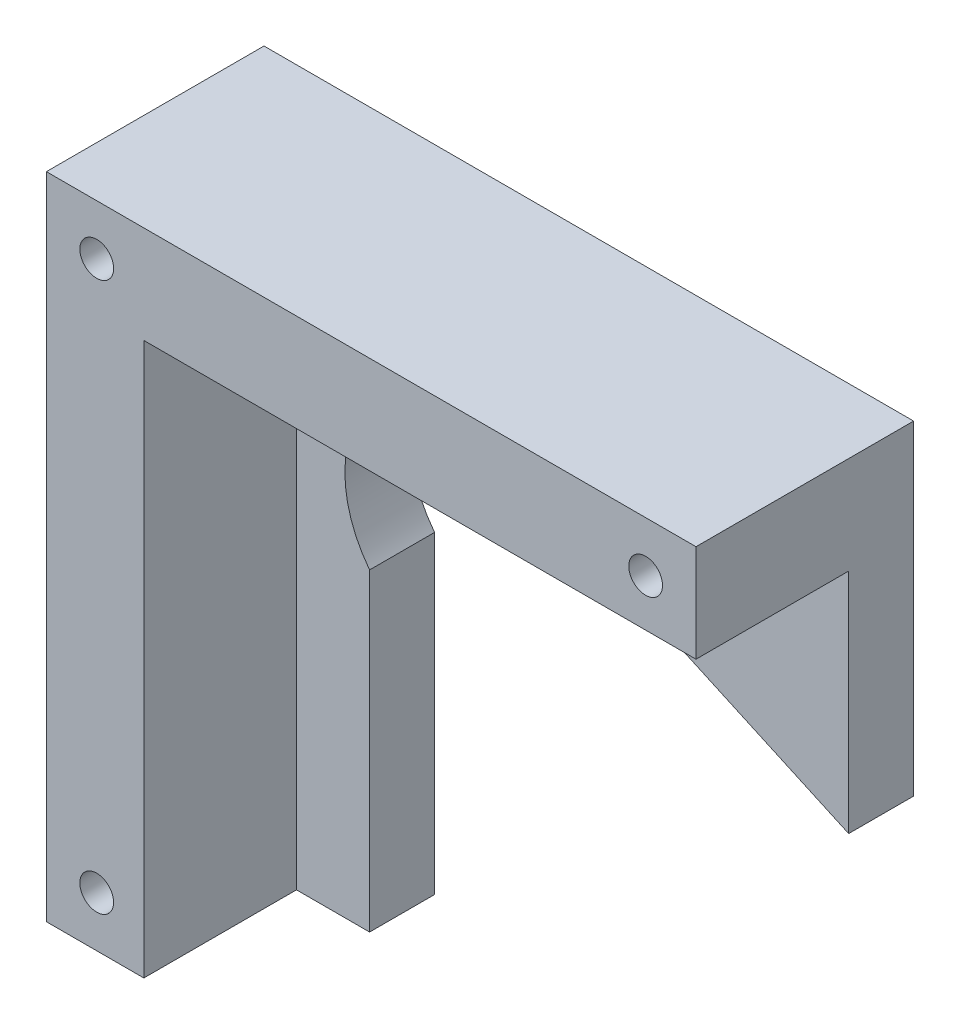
SolidWorks part; units mm, degrees
ref_plane "Plan de face" through (0, 0, 0) normal (0, 0, 1) x (1, 0, 0)
ref_plane "Plan de dessus" through (0, 0, 0) normal (0, 1, 0) x (1, 0, 0)
ref_plane "Plan de droite" through (0, 0, 0) normal (1, 0, 0) x (0, 0, -1)
sketch "Esquisse1" plane through (0, 0, 0) normal (0, 0, 1) x (1, 0, 0)
  line L1 (-59.9893, 29.8525) -> (40.0107, 29.8525)
  line L2 (-59.9893, 29.8525) -> (-59.9893, -70.1475)
  line L3 (-59.9893, -70.1475) -> (40.0107, -70.1475)
  line L4 (40.0107, 29.8525) -> (40.0107, -70.1475)
  dimension "D1" = 100
  dimension "D2" = 100
extrude "Boss.-Extru.1" add sketch "Esquisse1" along normal blind 33.5
sketch "Esquisse2" plane through (0, 0, 33.5) normal (0, 0, 1) x (1, 0, 0)
  line L1 (40.0107, -70.1475) -> (-44.9893, -70.1475)
  line L2 (40.0107, -70.1475) -> (40.0107, 14.8525)
  line L3 (40.0107, 14.8525) -> (-44.9893, 14.8525)
  line L4 (-44.9893, -70.1475) -> (-44.9893, 14.8525)
  line L5 (-59.9893, 29.8525) -> (-59.9893, -70.1475) construction
  line L6 (40.0107, 29.8525) -> (-59.9893, 29.8525) construction
  dimension "D1" = 15
  dimension "D3" = 15
extrude "Enlèv. mat.-Extru.1" cut sketch "Esquisse2" against normal blind 23.5
sketch "Esquisse3" plane through (0, 0, 0) normal (0, 0, 1) x (1, 0, 0)
  line L0 (-59.9893, 29.8525) -> (-59.9893, -70.1475) construction
  line L1 (-59.9893, -70.1475) -> (-44.9893, -70.1475) construction
  line L2 (40.0107, 29.8525) -> (-59.9893, 29.8525) construction
  line L3 (40.0107, 14.8525) -> (40.0107, 29.8525) construction
  line L6 (-59.9893, -70.1475) -> (40.0107, -70.1475) construction
  line L7 (-9.9893, -70.1475) -> (40.0107, -70.1475)
  line L8 (40.0107, -70.1475) -> (40.0107, -20.1475)
  line L9 (40.0107, -70.1475) -> (40.0107, 29.8525) construction
  line L10 (40.0107, -20.1475) -> (-5.0436, 0.371)
  line L11 (-33.7351, -21.866) -> (-33.7351, -70.1475)
  line L12 (-9.9893, -70.1475) -> (-33.7351, -70.1475)
  circle A0 centre (32.2607, 22.1025) radius 2.6
  circle A1 centre (-52.2393, -62.3975) radius 2.6
  circle A2 centre (-52.2393, 22.1025) radius 2.6
  arc A4 (-33.7351, -21.866) -> (-5.0436, 0.371) centre (-19.3893, -10.7475) cw
  dimension "D1" = 5.2
  dimension "D2" = 5.2
  dimension "D7" = 5.2
  dimension "D3" = 7.75
  dimension "D4" = 7.75
  dimension "D5" = 7.75
  dimension "D6" = 7.75
  dimension "D8" = 7.75
extrude "Enlèv. mat.-Extru.4" cut sketch "Esquisse3" along normal blind 40
